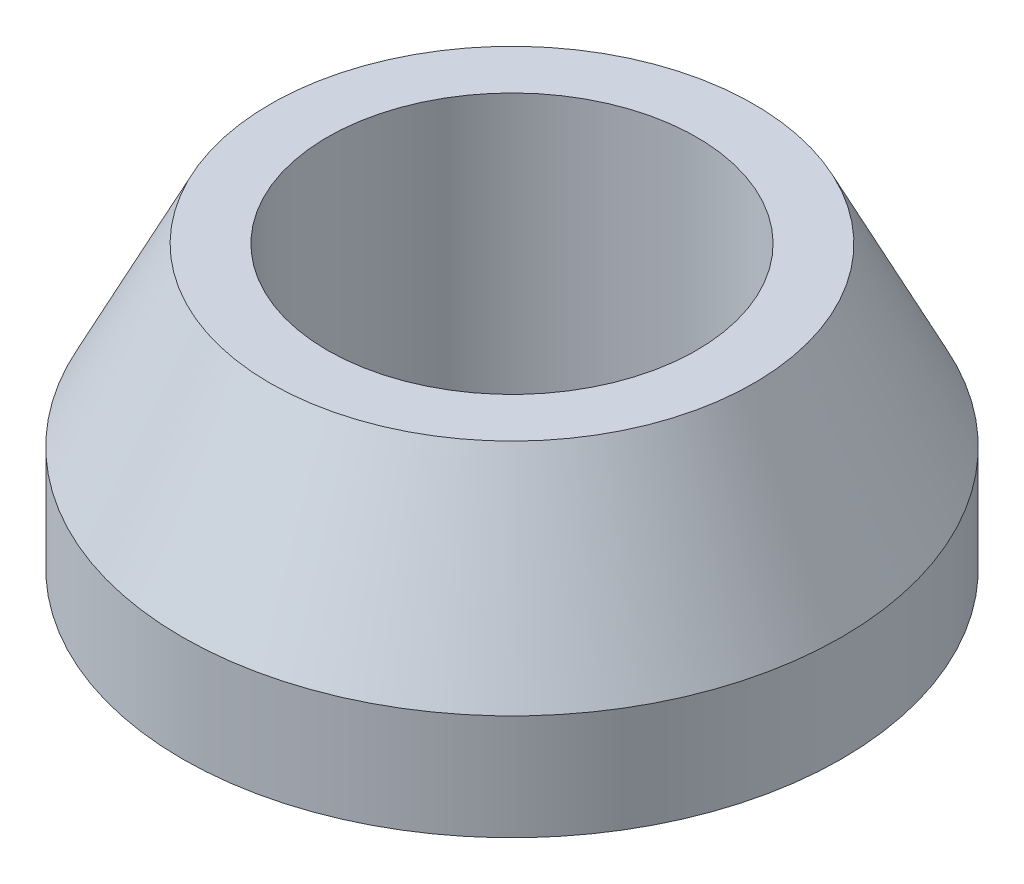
SolidWorks part; units mm, degrees
ref_plane "前视基准面" through (0, 0, 0) normal (0, 0, 1) x (1, 0, 0)
ref_plane "上视基准面" through (0, 0, 0) normal (0, 1, 0) x (1, 0, 0)
ref_plane "右视基准面" through (0, 0, 0) normal (1, 0, 0) x (0, 0, -1)
other "Configuration Table"
sketch "草图1" plane through (0, 0, 0) normal (0, 1, 0) x (1, 0, 0)
  circle A0 centre (0, 0) radius 3.75
  circle A1 centre (0, 0) radius 2.1
  dimension "D1" = 7.5
  dimension "D2" = 4.2
extrude "凸台-拉伸1" add sketch "草图1" along normal blind 3.2
chamfer "倒角1" distance 2 distance2 1 1 edges at (0, 3.2, 3.75)
